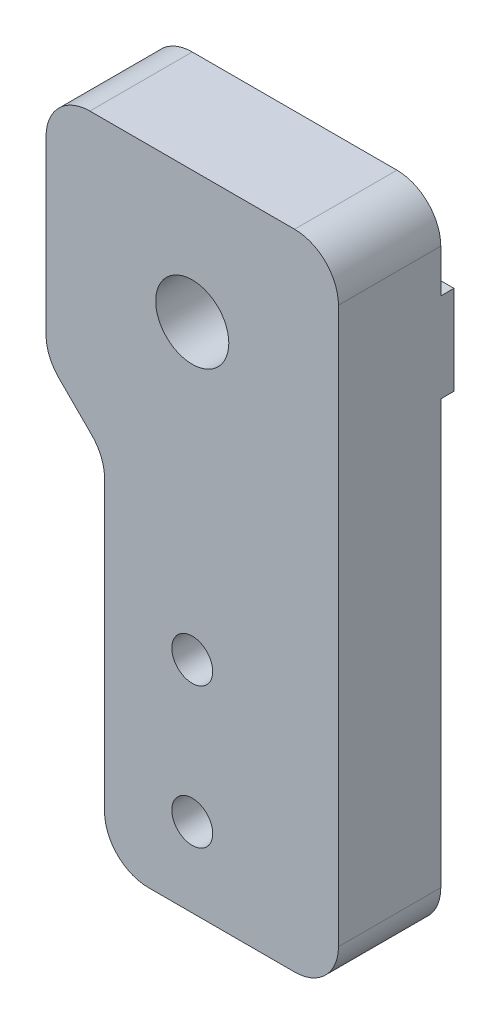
SolidWorks part; units mm, degrees
ref_plane "Front Plane" through (0, 0, 0) normal (0, 0, 1) x (1, 0, 0)
ref_plane "Top Plane" through (0, 0, 0) normal (0, 1, 0) x (1, 0, 0)
ref_plane "Right Plane" through (0, 0, 0) normal (1, 0, 0) x (0, 0, -1)
sketch "Sketch1" plane through (0, 0, 0) normal (0, 0, 1) x (1, 0, 0)
  line L0 (3, 0) -> (17, 0)
  line L1 (20, 3) -> (20, 41)
  line L2 (10, 0) -> (10, 44) construction
  line L4 (17, 44) -> (3, 44)
  line L5 (0, 41) -> (0, 3)
  line L6 (0, 35) -> (20, 35) construction
  line L8 (10, 0) -> (10, 44) construction
  circle A0 centre (10, 35) radius 2.5
  arc A1 (20, 41) -> (17, 44) centre (17, 41) ccw
  circle A2 centre (10, 5.4) radius 1.4
  circle A3 centre (10, 15) radius 1.4
  arc A7 (3, 44) -> (0, 41) centre (3, 41) ccw
  arc A8 (0, 3) -> (3, 0) centre (3, 3) ccw
  arc A9 (17, 0) -> (20, 3) centre (17, 3) ccw
  point P32 (0, 44)
  point P35 (0, 0)
  point P38 (20, 0)
  dimension "D5" = 5
  dimension "D6" = 10
  dimension "D7" = 10
  dimension "D10" = 2.8
  dimension "D11" = 2.8
  dimension "D12" = 5.4
  dimension "D13" = 9.6
  dimension "D3" = 3
  dimension "D4" = 3
  dimension "D1" = 44
  dimension "D2" = 20
  dimension "D9" = 9
extrude "Boss-Extrude1" add sketch "Sketch1" along normal blind 7
sketch "Sketch2" plane through (20, 0, 0) normal (1, 0, 0) x (0, 0, -1)
  line L1 (0, 38.05) -> (0.9, 38.05)
  line L2 (0, 38.05) -> (0, 31.95)
  line L3 (0, 31.95) -> (0.9, 31.95)
  line L4 (0.9, 38.05) -> (0.9, 31.95)
  line L6 (0, 3) -> (0, 41) construction
  line L7 (0.9, 35) -> (0, 35) construction
  dimension "D1" = 6.1
  dimension "D2" = 0.9
extrude "Boss-Extrude2" add sketch "Sketch2" against normal up to surface (20 mm away) contours L3 L4 L1 L2
sketch "Sketch3" plane through (0, 0, 0) normal (0, 0, 1) x (1, 0, 0)
  circle A0 centre (10, 35) radius 2.5 construction
  circle A2 centre (10, 35) radius 2.5
extrude "Cut-Extrude1" cut sketch "Sketch3" against normal up to next
sketch "Sketch4" plane through (0, 0, 7) normal (0, 0, 1) x (1, 0, 0)
  line L0 (0, 28) -> (4, 24)
  line L1 (0, 41) -> (0, 3) construction
  line L2 (4, 24) -> (4, 0)
  line L3 (3, 0) -> (17, 0) construction
  line L4 (0, 28) -> (0, 3)
  line L5 (3, 0) -> (4, 0)
  arc A0 (0, 3) -> (3, 0) centre (3, 3) ccw construction
  arc A1 (0, 3) -> (3, 0) centre (3, 3) ccw
  dimension "D1" = 4
  dimension "D2" = 135
  dimension "D3" = 28
extrude "Cut-Extrude2" cut sketch "Sketch4" against normal up to surface (7 mm away)
fillet "Fillet1" radius 3 3 edges at (0, 28, 3.5) (4, 24, 3.5) (4, 0, 3.5)
